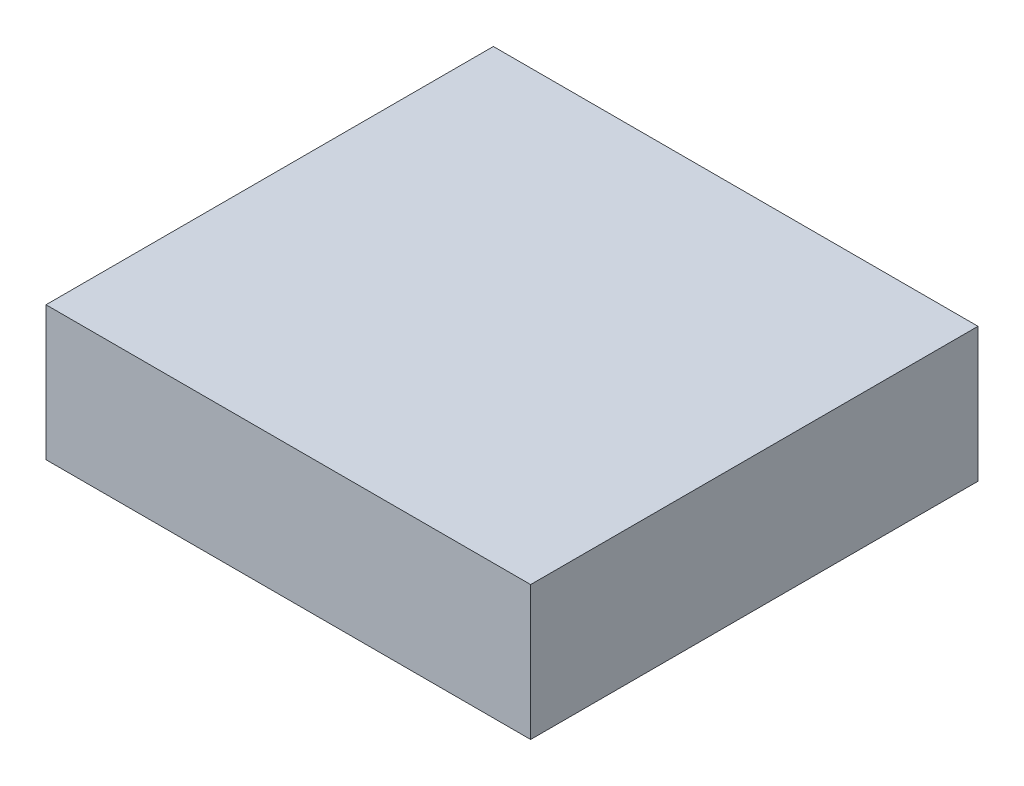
SolidWorks part; units mm, degrees
ref_plane "Front Plane" through (0, 0, 0) normal (0, 0, 1) x (1, 0, 0)
ref_plane "Top Plane" through (0, 0, 0) normal (0, 1, 0) x (1, 0, 0)
ref_plane "Right Plane" through (0, 0, 0) normal (1, 0, 0) x (0, 0, -1)
sketch "Sketch1" plane through (0, 0, 0) normal (0, 1, 0) x (1, 0, 0)
  line L1 (-32.5, 30) -> (32.5, 30)
  line L2 (-32.5, 30) -> (-32.5, -30)
  line L3 (-32.5, -30) -> (32.5, -30)
  line L4 (32.5, 30) -> (32.5, -30)
  line L5 (-32.5, 30) -> (32.5, -30) construction
  line L6 (-32.5, -30) -> (32.5, 30) construction
  point P0 (0, 0)
  dimension "D1" = 65
  dimension "D2" = 60
extrude "Boss-Extrude1" add sketch "Sketch1" along normal blind 18
